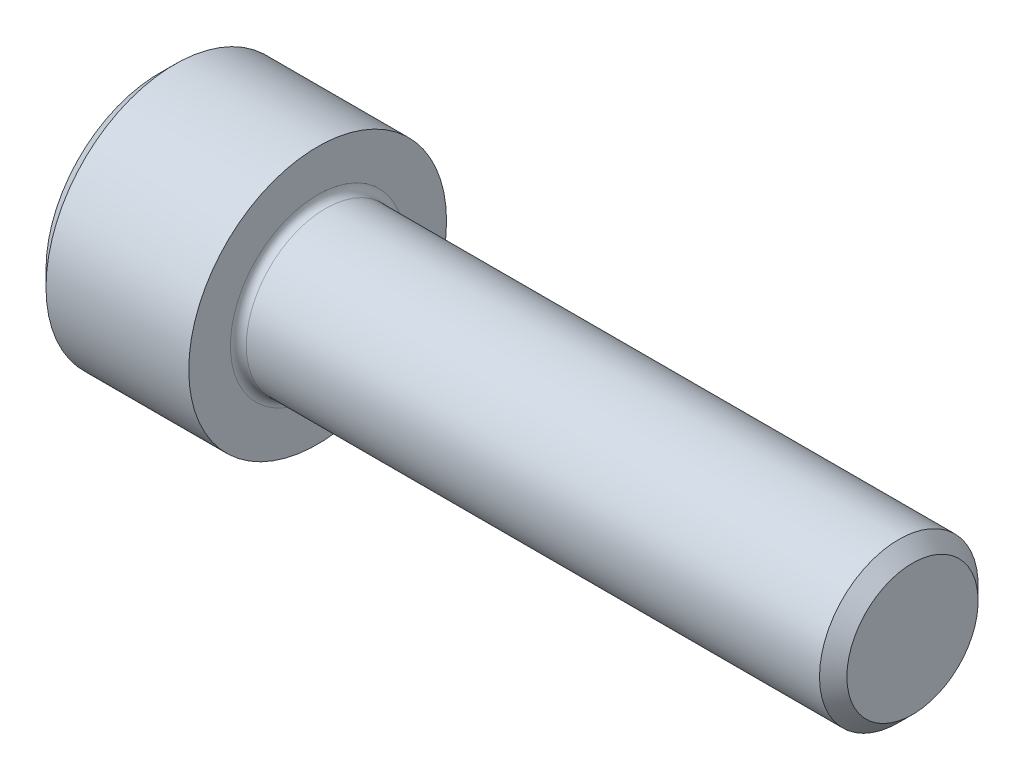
SolidWorks part; units mm, degrees
ref_plane "Plane1" through (0, 0, 0) normal (0, 0, 1) x (1, 0, 0)
ref_plane "Plane2" through (0, 0, 0) normal (0, 1, 0) x (1, 0, 0)
ref_plane "Plane3" through (0, 0, 0) normal (1, 0, 0) x (0, 0, -1)
revolve "Base-Revolve" add sketch "BodySke"
sketch "BodySke" plane through (0, 0, 0) normal (0, 0, 1) x (1, 0, 0)
  line L0 (0, 0) -> (0, 5.7)
  line L1 (0.8, 6.5) -> (8, 6.5)
  line L2 (8, 6.5) -> (8, 4)
  line L3 (8, 4) -> (37.3095, 4)
  line L4 (38, 3.3095) -> (38, 0)
  line L5 (38, 0) -> (0, 0)
  line L6 (-31.75, 0) -> (127, 0) construction
  line L7 (0, 5.7) -> (0.8, 6.5)
  line L8 (38, 3.3095) -> (37.3095, 4)
  line L9 (0, -5.7) -> (0.8, -6.5) construction
  line L10 (38, -3.3095) -> (37.3095, -4) construction
  line L11 (9.25, 9.525) -> (9.25, 3.175) construction
  line L12 (8, 9.525) -> (8, 3.175) construction
  line L13 (-12, 9.525) -> (-12, 3.175) construction
  dimension "Diameter" = 8
  dimension "Head_ht" = 8
  dimension "Length" = 30
  dimension "Body_ch_ang" = 45
  dimension "Head_dia" = 13
  dimension "Head_ch_ang" = 45
  dimension "Minor_dia" = 6.619
  dimension "Advance" = 1.25
  dimension "Thread_nom" = 30
  dimension "Thread_length" = 50
  dimension "Head_ch_ht" = 0.8
fillet "Fillet1" radius 0.4 1 edges at (8, 0, 4)
sketch "Sketch2" plane through (0, 0, 0) normal (0, 0, 1) x (1, 0, 0)
  line L0 (0, 3.0475) -> (4, 3.0475)
  line L1 (4, 3.0475) -> (5.7595, 0)
  line L2 (-31.75, 0) -> (127, 0) construction
  line L3 (5.7595, 0) -> (0, 0)
  line L4 (0, 0) -> (0, 3.0475)
  line L5 (0, 5.7) -> (0, -5.7) construction
  line L6 (0, 0) -> (47.625, 0) construction
  line L7 (8, -6.5) -> (8, 6.5) construction
  dimension "D1" = 3.0475
  dimension "D2" = 60
  dimension "Wall_thickness" = 4
revolve "Hex-PreBroach" cut sketch "Sketch2" angle 360 about L6
sketch "Sketch3" plane through (0, 0, 0) normal (-1, 0, 0) x (0, 0.5, 0.866)
  line L0 (1.7595, 3.0475) -> (-1.7595, 3.0475)
  line L1 (-1.7595, 3.0475) -> (-3.5189, 0)
  line L2 (1.7595, 3.0475) -> (3.5189, 0)
  line L3 (1.7595, -3.0475) -> (3.5189, 0)
  line L4 (1.7595, -3.0475) -> (-1.7595, -3.0475)
  line L5 (-1.7595, -3.0475) -> (-3.5189, 0)
  dimension "D1" = 3.0475
  dimension "D2" = 3.0475
  dimension "Hex_size" = 6.095
extrude "Hex" cut sketch "Sketch3" against normal blind 4
sketch "Sketch4" plane through (0, 0, 0) normal (-1, 0, 0) x (0, 0, 1)
  line L0 (0, 0) -> (3.7846, 0)
  line L1 (0, 0) -> (6.1484, 3.5498) construction
  line L2 (0, 0) -> (1.8923, 3.2776)
  line L3 (3.1235, 0.8061) -> (3.6229, 1.0945)
  line L4 (2.2599, 2.3019) -> (2.7593, 2.5903)
  arc A0 (3.1235, 0.8061) -> (2.2599, 2.3019) centre (0, 0) ccw
  arc A1 (3.7846, 0) -> (3.6229, 1.0945) centre (0, 0) ccw
  arc A2 (1.8923, 3.2776) -> (2.7593, 2.5903) centre (0, 0) cw
  dimension "D1" = 30
  dimension "Spline_n_dim" = 6.4516
  dimension "Spline_m_dim" = 7.5692
  dimension "D2" = 60
  dimension "D3" = 0.8636
  dimension "Spline_p_dim" = 1.7272
extrude "Spline" [suppressed] cut sketch "Sketch4" against normal blind 4
pattern_circular "CirPattern1" [suppressed] count 6 every 60
sketch "Sketch5" plane through (0, 0, 0) normal (0, 0, 1) x (1, 0, 0)
  line L0 (-31.75, 0) -> (127, 0) construction
  line L2 (0, 5.7) -> (0, -5.7) construction
  circle A0 centre (2.7, 0) radius 0.675
  dimension "Drilled_hole_dia" = 1.35
  dimension "Drilled_hole_loc" = 2.7
extrude "Hole" [suppressed] cut sketch "Sketch5" against normal through all and the other way through all
pattern_circular "Drilled-4" [suppressed] count 2 every 60
pattern_circular "Drilled-6" [suppressed] count 3 every 60
sketch "ThdSchSke" plane through (0, 0, 0) normal (0, 0, 1) x (1, 0, 0)
  line L0 (9.25, -3.3095) -> (8.7665, -4)
  line L1 (9.25, -3.3095) -> (9.7335, -4)
  line L2 (9.7335, -4) -> (9.7335, -5)
  line L3 (-3.175, 0) -> (5.1513, 0) construction
  line L5 (9.7335, -5) -> (8.7665, -5)
  line L6 (8.7665, -5) -> (8.7665, -4)
  line L7 (0, 5.7) -> (0, -5.7) construction
  dimension "Thread_minor" = 6.619
  dimension "Diameter" = 8
  dimension "Start" = 9.25
  dimension "SideAngle" = 55
  dimension "VeeAngle" = 70
  dimension "Overcut" = 10
revolve "ThreadSchematic" [suppressed] cut sketch "ThdSchSke" angle 360 about L3
pattern_linear "ThdSchPat" [suppressed]
equation "\"D2@Sketch3\" = \"Hex_size@Sketch3\" / 2"
equation "\"D1@Sketch3\" = \"Hex_size@Sketch3\" / 2"
equation "\"D1@Sketch2\" = \"Hex_size@Sketch3\" / 2"
equation "\"D3@Sketch4\" = \"Spline_p_dim@Sketch4\" / 2"
equation "\"Thread_minor@ThreadCosmetic\"  =  \"Minor_dia@BodySke\""
equation "\"D2@CirPattern1\" = 360 / \"Num_teeth@CirPattern1\""
equation "\"Wall_thickness@Sketch2\" = \"Head_ht@BodySke\" - \"Key_eng@Hex\""
equation "\"Thread_length@ThreadCosmetic\" = ((sgn( (\"Length@BodySke\" - \"Advance@BodySke\" ) - \"Thread_nom@BodySke\" )-1)*( (\"Length@BodySke\" - \"Advance@BodySke\" ) - \"Thread_nom@BodySke\" ))/-2+ \"Thread_nom@BodySke\""
equation "\"Thread_minor@ThdSchSke\" = \"Minor_dia@BodySke\""
equation "\"Diameter@ThdSchSke\" = \"Diameter@BodySke\""
equation "\"Overcut@ThdSchSke\" = \"Diameter@BodySke\" * 1.25"
equation "\"Start@ThdSchSke\" = \"Head_ht@BodySke\" + \"Length@BodySke\" - \"Thread_length@ThreadCosmetic\"  '---Non-countersunk---"
equation "\"Num_threads@ThdSchPat\" = int( \"Thread_length@ThreadCosmetic\" / \"Advance@BodySke\" + 0.999 )  + 1"
equation "\"Advance@ThdSchPat\" = \"Thread_length@ThreadCosmetic\" /  (\"Num_threads@ThdSchPat\" - 1) 'relax it"
equation "\"Num_threads@ThdSchPat\" = \"Num_threads@ThdSchPat\" - sgn( \"Num_threads@ThdSchPat\" - 1) '---chamfered tips only---"
